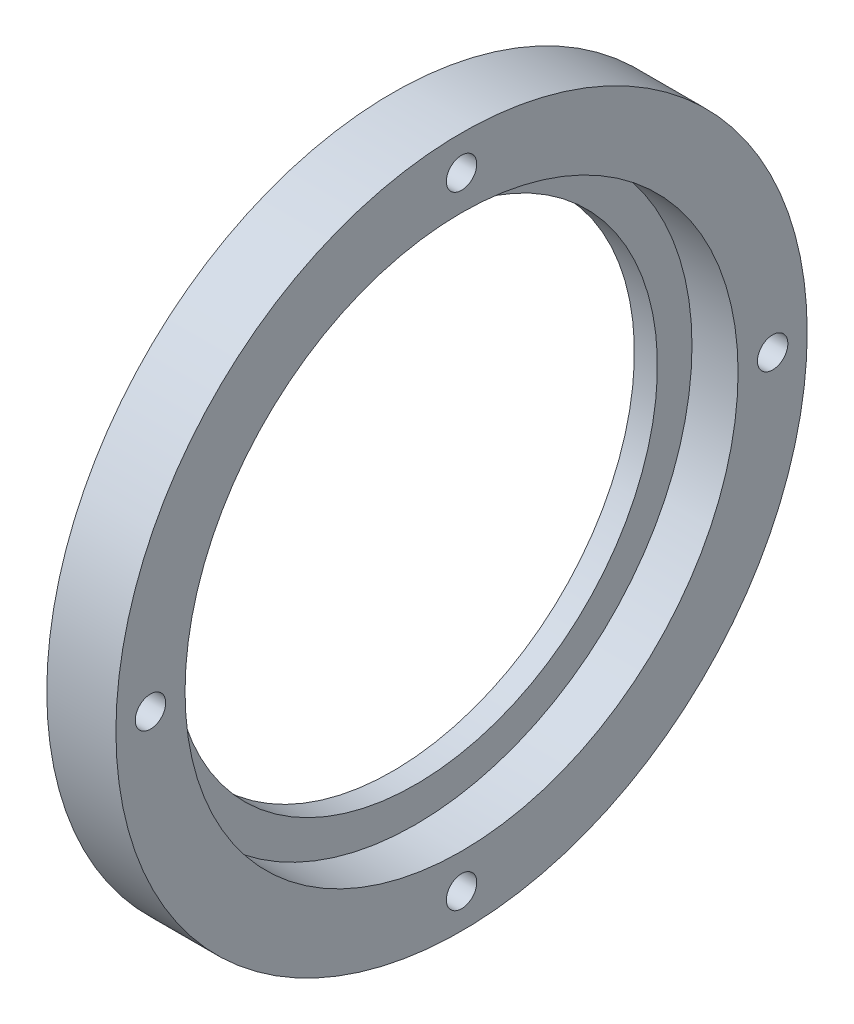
SolidWorks part; units mm, degrees
ref_plane "Plan1" through (0, 0, 0) normal (0, 0, 1) x (1, 0, 0)
ref_plane "Plan2" through (0, 0, 0) normal (0, 1, 0) x (1, 0, 0)
ref_plane "Plan3" through (0, 0, 0) normal (1, 0, 0) x (0, 0, -1)
sketch "Esquisse1" plane through (0, 0, 0) normal (0, 0, 1) x (1, 0, 0)
  line L0 (-16.7089, 0) -> (89.0566, 0) construction
  line L1 (0, 52.5) -> (0, 75)
  line L2 (0, 75) -> (15, 75)
  line L3 (15, 75) -> (15, 60)
  line L4 (15, 60) -> (5, 60)
  line L5 (5, 60) -> (5, 52.5)
  line L6 (5, 52.5) -> (0, 52.5)
  dimension "D1" = 15
  dimension "D2" = 75
  dimension "D3" = 60
  dimension "D4" = 52.5
  dimension "D5" = 10
revolve "Base-Révolution" add sketch "Esquisse1" angle 360 about L0
hole_wizard "Perçage1" positions "Esquisse3" profile "Esquisse2" hole size "M6" standard "ISO"
sketch "Esquisse3" plane through (0, 0, 0) normal (-1, 0, 0) x (0, 0, 1)
  circle A0 centre (0, 0) radius 75 construction
  point P0 (0, 67.5)
  point P1 (67.5, 0)
  point P2 (0, -67.5)
  point P3 (-67.5, 0)
  dimension "D1" = 67.5
  dimension "D2" = 67.5
  dimension "D3" = 67.5
  dimension "D4" = 67.5
sketch "Esquisse2" plane through (0, 67.5, 0) normal (0, 1, 0) x (0, 0, 1)
  line L0 (0, 0) -> (0, 15)
  line L1 (0, 15) -> (3.3, 15)
  line L2 (3.3, 15) -> (3.3, 0)
  line L5 (3.3, 0) -> (0, 0)
  line L11 (0, -6.35) -> (0, 107.95) construction
  dimension "Diamètre du perçage jusqu'au prochain" = 6.6
  dimension "Profondeur du perçage jusqu'au prochain" = 15
